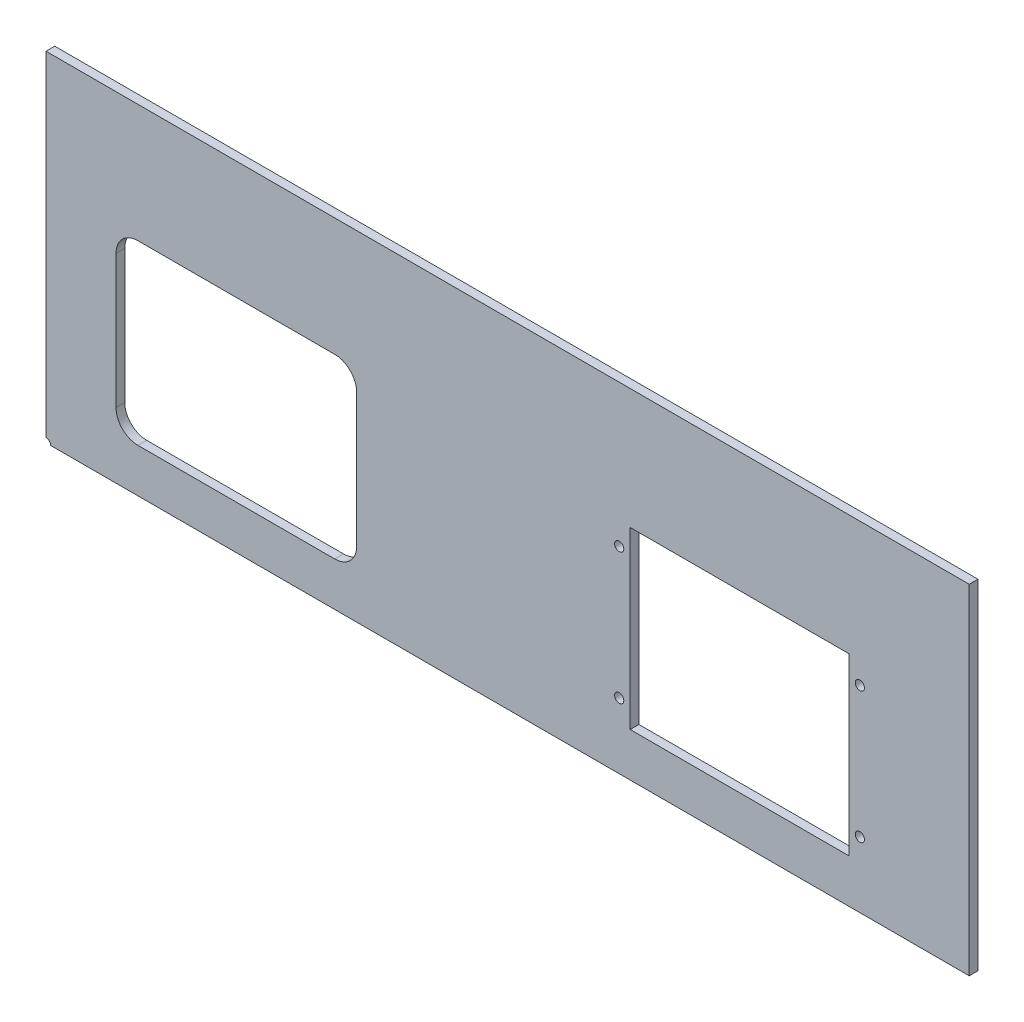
SolidWorks part; units mm, degrees
ref_plane "Alzado" through (0, 0, 0) normal (0, 0, 1) x (1, 0, 0)
ref_plane "Planta" through (0, 0, 0) normal (0, 1, 0) x (1, 0, 0)
ref_plane "Vista lateral" through (0, 0, 0) normal (1, 0, 0) x (0, 0, -1)
sketch "Sketch1" plane through (0, 0, 0) normal (0, 0, 1) x (1, 0, 0)
  line L1 (0, 0) -> (422, 0)
  line L2 (0, 0) -> (0, 155)
  line L3 (0, 155) -> (422, 155)
  line L4 (422, 0) -> (422, 155)
  dimension "D1" = 155
  dimension "D2" = 422
extrude "Boss-Extrude1" add sketch "Sketch1" along normal blind 4
sketch "Sketch2" plane through (0, 0, 4) normal (0, 0, 1) x (1, 0, 0)
  line L1 (42, 101) -> (132, 101)
  line L2 (32, 91) -> (32, 30)
  line L3 (42, 20) -> (132, 20)
  line L4 (142, 91) -> (142, 30)
  line L5 (0, 155) -> (0, 0) construction
  line L6 (0, 0) -> (422, 0) construction
  arc A0 (42, 101) -> (32, 91) centre (42, 91) ccw
  arc A1 (42, 20) -> (32, 30) centre (42, 30) cw
  arc A2 (142, 30) -> (132, 20) centre (132, 30) cw
  arc A3 (142, 91) -> (132, 101) centre (132, 91) ccw
  dimension "D5" = 10
  dimension "D1" = 81
  dimension "D2" = 32
  dimension "D3" = 20
  dimension "D4" = 110
extrude "Cut-Extrude1" cut sketch "Sketch2" against normal through all
sketch "Sketch3" plane through (0, 0, 4) normal (0, 0, 1) x (1, 0, 0)
  line L0 (422, 0) -> (422, 155) construction
  line L1 (367, 20) -> (267, 20)
  line L2 (367, 20) -> (367, 100)
  line L3 (367, 100) -> (267, 100)
  line L4 (267, 20) -> (267, 100)
  line L5 (0, 0) -> (422, 0) construction
  line L6 (317, -8.853) -> (317, 118.4216) construction
  circle A0 centre (0, 0) radius 2.1
  circle A1 centre (372, 90) radius 2.1
  circle A2 centre (372, 30) radius 2.1
  circle A3 centre (262, 30) radius 2.1
  circle A4 centre (262, 90) radius 2.1
  dimension "D5" = 5
  dimension "D7" = 4.2
  dimension "D8" = 4.2
  dimension "D9" = 10
  dimension "D1" = 55
  dimension "D2" = 100
  dimension "D3" = 80
  dimension "D4" = 20
  dimension "D6" = 10
  dimension "D10" = 5
  dimension "D11" = 50
extrude "Cut-Extrude2" cut sketch "Sketch3" against normal up to surface (4 mm away)
equation "\"material\"=3"
